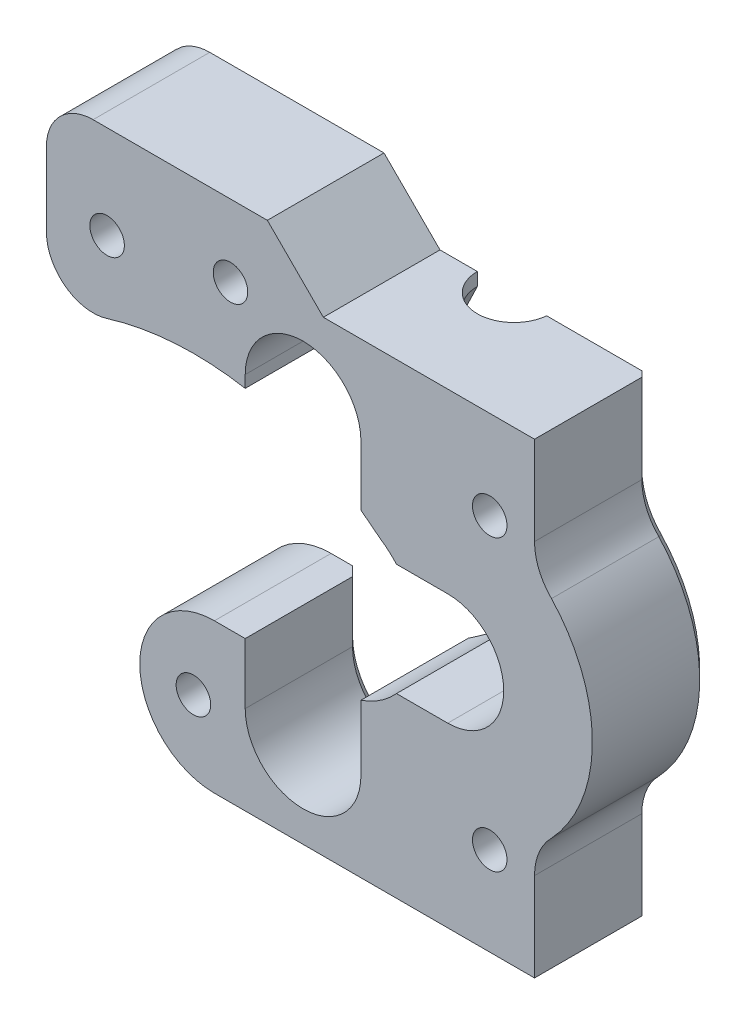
SolidWorks part; units mm, degrees
ref_plane "Front Plane" through (0, 0, 0) normal (0, 0, 1) x (1, 0, 0)
ref_plane "Top Plane" through (0, 0, 0) normal (0, 1, 0) x (1, 0, 0)
ref_plane "Right Plane" through (0, 0, 0) normal (1, 0, 0) x (0, 0, -1)
sketch "Sketch1" plane through (0, 0, 0) normal (0, 0, 1) x (1, 0, 0)
  line L1 (0, 0) -> (50, 0)
  line L2 (0, 0) -> (0, 50)
  line L3 (0, 50) -> (50, 50)
  line L4 (50, 0) -> (50, 50)
  dimension "D1" = 50
  dimension "D2" = 50
extrude "Boss-Extrude1" add sketch "Sketch1" along normal blind 15
sketch "Sketch2" plane through (0, 0, 15) normal (0, 0, 1) x (1, 0, 0)
  line L0 (25, 50) -> (25, 0) construction
  line L1 (50, 50) -> (0, 50) construction
  line L2 (0, 0) -> (50, 0) construction
  line L3 (0, 25) -> (50, 25) construction
  line L4 (0, 50) -> (0, 0) construction
  line L5 (50, 0) -> (50, 50) construction
  circle A0 centre (40.5, 40.5) radius 1.75
  circle A1 centre (9.5, 40.5) radius 1.75
  circle A2 centre (9.5, 9.5) radius 1.75
  circle A3 centre (40.5, 9.5) radius 1.75
  dimension "D1" = 3.5
  dimension "D2" = 3.5
  dimension "D3" = 3.5
  dimension "D4" = 3.5
  dimension "D5" = 15.5
  dimension "D6" = 15.5
  dimension "D7" = 15.5
  dimension "D9" = 15.5
  dimension "D10" = 15.5
  dimension "D11" = 15.5
  dimension "D12" = 15.5
  dimension "D8" = 15.5
extrude "Cut-Extrude1" cut sketch "Sketch2" against normal up to surface (15 mm away)
sketch "Sketch3" plane through (0, 0, 15) normal (0, 0, 1) x (1, 0, 0)
  line L0 (0, 50) -> (50, 0) construction
  circle A0 centre (25, 25) radius 6
  dimension "D1" = 12
extrude "Cut-Extrude2" cut sketch "Sketch3" against normal up to surface (15 mm away)
ref_plane "Plane1" through (0, 0, 15) normal (0, -1, 0) x (-1, 0, 0)
sketch "Sketch4" plane through (0, 50, 0) normal (0, 1, 0) x (1, 0, 0)
  line L0 (50, -7.5) -> (0, -7.5) construction
  line L1 (50, -15) -> (50, 0) construction
  line L2 (0, -15) -> (0, 0) construction
  line L3 (25, 0) -> (25, -15) construction
  line L4 (50, 0) -> (0, 0) construction
  line L5 (50, -15) -> (0, -15) construction
  circle A0 centre (19.6, -7.5) radius 1.75
  dimension "D1" = 5.4
  dimension "D2" = 3.5
extrude "Cut-Extrude3" cut sketch "Sketch4" against normal up to surface (50 mm away)
sketch "Sketch5" plane through (0, 50, 0) normal (0, 1, 0) x (1, 0, 0)
  circle A0 centre (19.6, -7.5) radius 3.925
  dimension "D1" = 7.85
extrude "Cut-Extrude4" cut sketch "Sketch5" against normal blind 1.39
sketch "Sketch6" plane through (0, 48.61, 0) normal (0, 1, 0) x (1, 0, 0)
  circle A0 centre (19.6, -7.5) radius 5.25
  dimension "D1" = 10.5
extrude "Cut-Extrude5" cut sketch "Sketch6" against normal blind 2.75
chamfer "Chamfer1" distance 1.325 distance2 2.75 1 edges at (19.6, 48.61, 12.75)
sketch "Sketch7" plane through (0, 45.86, 0) normal (0, 1, 0) x (1, 0, 0)
  circle A0 centre (19.6, -7.5) radius 5.3006
extrude "Cut-Extrude6" cut sketch "Sketch7" against normal blind 4.4
sketch "Sketch8" plane through (0, 41.46, 0) normal (0, 1, 0) x (1, 0, 0)
  circle A0 centre (19.6, -7.5) radius 3.55
  dimension "D1" = 7.1
extrude "Cut-Extrude7" cut sketch "Sketch8" against normal blind 4
sketch "Sketch21" plane through (0, 0, 15) normal (0, 0, 1) x (1, 0, 0)
  line L0 (25, 31) -> (25, 19)
  line L1 (25, 19) -> (0, 19)
  line L2 (0, 50) -> (0, 0) construction
  line L3 (0, 19) -> (0, 31)
  line L4 (0, 31) -> (25, 31)
  circle A0 centre (25, 25) radius 6 construction
extrude "Cut-Extrude8" cut sketch "Sketch21" against normal through all
chamfer "Chamfer2" distance 1.5 distance2 5 1 edges at (19.6, 31, 9.25)
sketch "Sketch22" plane through (0, 0, 15) normal (0, 0, 1) x (1, 0, 0)
  line L0 (31, 25) -> (0, 25) construction
  line L2 (0, 50) -> (0, 31) construction
  arc A0 (25, 19) -> (25, 31) centre (25, 25) ccw construction
  circle A1 centre (12.8, 25) radius 9
  dimension "D1" = 18
  dimension "D2" = 12.8
extrude "Cut-Extrude9" cut sketch "Sketch22" against normal through all
sketch "Sketch23" plane through (0, 0, 15) normal (0, 0, 1) x (1, 0, 0)
  line L0 (12.8, 34) -> (12.8, 16)
  line L1 (12.8, 16) -> (0, 16)
  line L2 (0, 19) -> (0, 0) construction
  line L3 (0, 16) -> (0, 34)
  line L4 (0, 50) -> (0, 31) construction
  line L5 (0, 34) -> (12.8, 34)
  arc A0 (19.5082, 31) -> (6.0918, 31) centre (12.8, 25) ccw construction
  arc A1 (6.0918, 19) -> (19.5082, 19) centre (12.8, 25) ccw construction
extrude "Cut-Extrude11" cut sketch "Sketch23" against normal through all contours L3 L5 L0 L1
sketch "Sketch24" plane through (0, 0, 15) normal (0, 0, 1) x (1, 0, 0)
  line L0 (40.5, 40.5) -> (9.5, 40.5) construction
  circle A0 centre (29.5, 40.5) radius 1.85
  circle A1 centre (40.5, 40.5) radius 1.75 construction
  dimension "D1" = 3.7
  dimension "D2" = 11
extrude "Cut-Extrude12" cut sketch "Sketch24" against normal through all
sketch "Sketch25" plane through (0, 0, 0) normal (0, 0, -1) x (-1, 0, 0)
  line L1 (-34.1765, 40.5) -> (-31.8383, 36.45)
  line L2 (-31.8383, 36.45) -> (-27.1617, 36.45)
  line L3 (-27.1617, 36.45) -> (-24.8235, 40.5)
  line L4 (-24.8235, 40.5) -> (-27.1617, 44.55)
  line L5 (-27.1617, 44.55) -> (-31.8383, 44.55)
  line L6 (-31.8383, 44.55) -> (-34.1765, 40.5)
  circle A0 centre (-29.5, 40.5) radius 4.05 construction
  dimension "D1" = 8.1
extrude "Cut-Extrude13" cut sketch "Sketch25" against normal blind 3
sketch "Sketch27" plane through (0, 0, 15) normal (0, 0, 1) x (1, 0, 0)
  line L0 (40.5, 9.5) -> (9.5, 9.5) construction
  line L1 (29.5, 40.5) -> (29.5, 9.5) construction
  circle A0 centre (29.5, 9.5) radius 1.85
  dimension "D1" = 3.7
extrude "Cut-Extrude14" cut sketch "Sketch27" against normal through all
sketch "Sketch28" plane through (0, 0, 0) normal (0, 0, -1) x (-1, 0, 0)
  line L1 (-24.8235, 9.5) -> (-27.1617, 13.55)
  line L2 (-27.1617, 13.55) -> (-31.8383, 13.55)
  line L3 (-31.8383, 13.55) -> (-34.1765, 9.5)
  line L4 (-34.1765, 9.5) -> (-31.8383, 5.45)
  line L5 (-31.8383, 5.45) -> (-27.1617, 5.45)
  line L6 (-27.1617, 5.45) -> (-24.8235, 9.5)
  circle A0 centre (-29.5, 9.5) radius 4.05 construction
  dimension "D1" = 8.1
extrude "Cut-Extrude15" cut sketch "Sketch28" against normal up to surface (3 mm away)
sketch "Sketch26" plane through (0, 0, 15) normal (0, 0, 1) x (1, 0, 0)
  line L0 (11.6731, 50) -> (11.6731, 56)
  line L1 (50, 50) -> (0, 50) construction
  line L2 (11.6731, 56) -> (0, 56)
  line L3 (0, 56) -> (0, 50)
  line L13 (12.8, 16) -> (0, 16)
  line L14 (0, 16) -> (0, 0)
  line L15 (0, 0) -> (50, 0)
  line L16 (50, 0) -> (50, 50)
  line L17 (50, 50) -> (0, 50)
  line L18 (0, 50) -> (0, 34)
  line L19 (0, 34) -> (12.8, 34)
  line L20 (19.5082, 31) -> (25, 31)
  line L21 (25, 19) -> (19.5082, 19)
  line L26 (11.6731, 50) -> (0, 50)
  arc A3 (19.5082, 31) -> (12.8, 34) centre (12.8, 25) ccw
  arc A4 (25, 19) -> (25, 31) centre (25, 25) ccw
  arc A5 (12.8, 16) -> (19.5082, 19) centre (12.8, 25) ccw
  dimension "D2" = 6
  dimension "D1" = 0
extrude "Boss-Extrude5" add sketch "Sketch26" against normal up to surface (15 mm away)
sketch "Sketch29" plane through (0, 0, 0) normal (0, 0, -1) x (-1, 0, 0)
  line L0 (0, 34) -> (0, 56)
  line L1 (0, 56) -> (8, 56)
  line L2 (8, 56) -> (8, 34)
  line L3 (8, 34) -> (0, 34)
  dimension "D1" = 8
extrude "Boss-Extrude6" add sketch "Sketch29" against normal up to surface (15 mm away)
sketch "Sketch30" plane through (0, 0, 15) normal (0, 0, 1) x (1, 0, 0)
  line L0 (9.5, 40.5) -> (9.5, 56) construction
  line L1 (11.6731, 56) -> (-8, 56) construction
  line L2 (9.5, 40.5) -> (-8, 58) construction
  line L3 (-8, 56) -> (-8, 34) construction
  circle A0 centre (1.7218, 48.2782) radius 1.85
  circle A1 centre (9.5, 40.5) radius 1.75 construction
  dimension "D2" = 3.7
  dimension "D3" = 11
  dimension "D4" = 7.7782
  dimension "D1" = 45
extrude "Cut-Extrude16" cut sketch "Sketch30" against normal through all
sketch "Sketch31" plane through (0, 0, 0) normal (0, 0, -1) x (-1, 0, 0)
  line L1 (-6.3984, 48.2782) -> (-4.0601, 44.2282)
  line L2 (-4.0601, 44.2282) -> (0.6164, 44.2282)
  line L3 (0.6164, 44.2282) -> (2.9547, 48.2782)
  line L4 (2.9547, 48.2782) -> (0.6164, 52.3282)
  line L5 (0.6164, 52.3282) -> (-4.0601, 52.3282)
  line L6 (-4.0601, 52.3282) -> (-6.3984, 48.2782)
  circle A0 centre (-1.7218, 48.2782) radius 4.05 construction
  dimension "D1" = 8.1
extrude "Cut-Extrude17" cut sketch "Sketch31" against normal up to surface (3 mm away)
sketch "Sketch32" plane through (0, 0, 0) normal (-1, 0, 0) x (0, 0, 1)
  line L0 (15, 16) -> (15, 0) construction
  line L1 (0, 16) -> (15, 16)
  line L2 (0, 16) -> (0, 0)
  line L3 (0, 0) -> (15, 0)
  line L4 (15, 16) -> (15, 0)
extrude "Boss-Extrude7" add sketch "Sketch32" along normal up to surface (8 mm away)
sketch "Sketch33" plane through (0, 0, 0) normal (0, 0, -1) x (-1, 0, 0)
  line L0 (8, 56) -> (-50, 56)
  line L1 (-50, 56) -> (-50, 0)
  line L2 (-50, 0) -> (8, 0)
  line L3 (8, 0) -> (8, 56)
extrude "Cut-Extrude18" cut sketch "Sketch33" against normal blind 7.5
sketch "Sketch34" plane through (0, 0, 15) normal (0, 0, 1) x (1, 0, 0)
  line L0 (40.5, 40.5) -> (-8, 40.5) construction
  line L1 (-8, 56) -> (-8, 34) construction
  line L2 (40.5, 9.5) -> (-8, 9.5) construction
  line L3 (-8, 0) -> (-8, 16) construction
  line L4 (12.8, 16) -> (-8, 16) construction
  line L5 (3.3, 40.5) -> (3.3, 34)
  line L6 (3.3, 34) -> (15.7, 33.52)
  line L7 (15.7, 33.52) -> (15.7, 40.5)
  line L8 (15.7, 16.48) -> (3.3, 16)
  line L9 (3.3, 16) -> (3.3, 9.5)
  line L10 (15.7, 16.48) -> (15.7, 9.5)
  line L11 (-8, 34) -> (12.8, 34) construction
  circle A0 centre (40.5, 40.5) radius 6.2
  circle A1 centre (40.5, 9.5) radius 6.2
  arc A2 (3.3, 40.5) -> (15.7, 40.5) centre (9.5, 40.5) cw
  arc A3 (15.7, 9.5) -> (3.3, 9.5) centre (9.5, 9.5) cw
  arc A6 (12.8, 16) -> (19.5082, 19) centre (12.8, 25) ccw construction
  arc A7 (19.5082, 31) -> (12.8, 34) centre (12.8, 25) ccw construction
  dimension "D1" = 12.4
  dimension "D2" = 12.4
  dimension "D3" = 6.2
  dimension "D4" = 6.2
extrude "Cut-Extrude19" cut sketch "Sketch34" against normal through all contours A3 L9 L8 L10 | L7 A2 L5 L6
sketch "Sketch35" plane through (0, 0, 15) normal (0, 0, 1) x (1, 0, 0)
  circle A0 centre (-2.25, 8) radius 1.85
  dimension "D1" = 3.7
extrude "Cut-Extrude20" cut sketch "Sketch35" against normal through all
sketch "Sketch39" plane through (0, 0, 15) normal (0, 0, 1) x (1, 0, 0)
  line L0 (-8, 56) -> (11.6731, 56)
  line L1 (11.6731, 56) -> (11.6731, 50)
  line L2 (11.6731, 50) -> (50, 50)
  line L3 (50, 50) -> (50, 0)
  line L4 (50, 0) -> (-8, 0)
  line L5 (-8, 0) -> (-8, 16)
  line L6 (-8, 16) -> (3.3, 16)
  line L7 (3.3, 16) -> (3.3, 9.5)
  line L8 (15.7, 9.5) -> (15.7, 16.48)
  line L9 (19.5082, 19) -> (25, 19)
  line L10 (19.5082, 19) -> (25, 19) construction
  line L11 (25, 31) -> (19.5082, 31)
  line L12 (15.7, 33.52) -> (15.7, 40.5)
  line L13 (15.7, 33.52) -> (15.7, 40.5) construction
  line L14 (3.3, 40.5) -> (3.3, 34)
  line L15 (3.3, 34) -> (-8, 34)
  line L16 (-8, 34) -> (-8, 56)
  arc A0 (25, 19) -> (25, 31) centre (25, 25) ccw construction
  arc A1 (15.7, 40.5) -> (3.3, 40.5) centre (9.5, 40.5) ccw construction
  circle A2 centre (1.7218, 48.2782) radius 1.85
  circle A3 centre (29.5, 40.5) radius 1.85
  circle A4 centre (40.5, 40.5) radius 6.2
  circle A5 centre (40.5, 9.5) radius 6.2
  circle A6 centre (29.5, 9.5) radius 1.85
  circle A7 centre (-2.25, 8) radius 1.85
  arc A8 (25, 31) -> (25, 19) centre (25, 25) cw
  arc A9 (15.7, 33.52) -> (19.5082, 31) centre (12.8, 25) cw
  arc A10 (19.5082, 19) -> (15.7, 16.48) centre (12.8, 25) cw
  arc A11 (3.3, 9.5) -> (15.7, 9.5) centre (9.5, 9.5) ccw
  arc A12 (3.3, 40.5) -> (15.7, 40.5) centre (9.5, 40.5) cw
extrude "Boss-Extrude10" add sketch "Sketch39" along normal blind 5 contours M26 M7 M8 M9 M10 M11 M12 M13 M14 M15 M16 M17 M18 M19 M20 M21 M22 M23 M24 M25 M2 M4 M6 M5 M3 M1
fillet "Fillet2" radius 8 2 edges at (-8, 16, 13.75) (-8, 0, 13.75)
sketch "Sketch40" plane through (0, 0, 20) normal (0, 0, 1) x (1, 0, 0)
  line L0 (-8, 34) -> (-18, 34)
  line L1 (-18, 34) -> (-18, 56)
  line L3 (-18, 56) -> (-8, 56)
  line L4 (-8, 56) -> (-8, 34)
  dimension "D1" = 10
extrude "Boss-Extrude11" add sketch "Sketch40" against normal up to surface (12.5 mm away)
sketch "Sketch42" plane through (0, 0, 20) normal (0, 0, 1) x (1, 0, 0)
  line L0 (-18, 56) -> (-18, 34) construction
  line L1 (-18, 34) -> (3.3, 34) construction
  circle A0 centre (-11.5, 46) radius 1.85
  dimension "D1" = 3.7
  dimension "D2" = 6.5
  dimension "D3" = 12
extrude "Cut-Extrude22" cut sketch "Sketch42" against normal through all
sketch "Sketch43" plane through (0, 0, 20) normal (0, 0, 1) x (1, 0, 0)
  line L1 (3.3, 34) -> (3.3, 40.5) construction
  line L2 (-18, 56) -> (-18, 34) construction
  line L3 (-18, 35.4702) -> (-18, 34)
  line L4 (-18, 34) -> (3.3, 34)
  line L5 (3.3, 34) -> (3.3, 39.2151)
  arc A0 (3.3, 39.2151) -> (-18, 35.4702) centre (-2.1892, 7.9892) ccw
extrude "Cut-Extrude23" cut sketch "Sketch43" against normal through all
chamfer "Chamfer3" distance 6 angle 45 1 edges at (11.6731, 56, 13.75)
fillet "Fillet3" radius 5 2 edges at (-18, 56, 13.75) (-18, 35.4702, 13.75)
sketch "Sketch44" plane through (0, 0, 20) normal (0, 0, 1) x (1, 0, 0)
  line L0 (34.3, 40.5) -> (34.3, 50)
  line L1 (50, 50) -> (11.6731, 50) construction
  line L2 (34.3, 9.5) -> (34.3, 0)
  line L3 (0, 0) -> (50, 0) construction
  line L4 (40.5, 40.5) -> (34.3, 40.5) construction
  line L5 (40.5, 9.5) -> (34.3, 9.5) construction
  line L6 (40.5, 40.5) -> (36.1159, 36.1159) construction
  line L7 (40.5, 9.5) -> (36.1159, 13.8841) construction
  line L8 (40.5, 40.5) -> (40.5, 9.5) construction
  line L9 (34.3, 50) -> (50, 50)
  line L10 (50, 50) -> (50, 0)
  line L11 (50, 0) -> (34.3, 0)
  circle A0 centre (40.5, 40.5) radius 6.2 construction
  circle A1 centre (40.5, 9.5) radius 6.2 construction
  arc A2 (36.1159, 36.1159) -> (36.1159, 13.8841) centre (24.2156, 25) cw
  arc A3 (34.3, 40.5) -> (36.1159, 36.1159) centre (40.5, 40.5) ccw
  arc A4 (36.1159, 13.8841) -> (34.3, 9.5) centre (40.5, 9.5) ccw
  dimension "D1" = 45
  dimension "D2" = 45
extrude "Cut-Extrude24" cut sketch "Sketch44" against normal through all
sketch "Sketch45" plane through (0, 56, 0) normal (0, 1, 0) x (1, 0, 0)
  line L0 (-16, -7.5) -> (-18, -7.5)
  line L1 (-13, -7.5) -> (-18, -7.5) construction
  line L2 (-18, -7.5) -> (-18, -8.5)
  line L3 (-18, -20) -> (-18, -7.5) construction
  line L4 (-18, -8.5) -> (-16, -7.5)
  dimension "D1" = 2
  dimension "D2" = 1
extrude "Cut-Extrude25" cut sketch "Sketch45" against normal up to vertex
chamfer "Chamfer4" distance 1 angle 45 5 edges at (34.7719, 11.8726, 7.5) (34.3, 4.75, 7.5) (40.5, 25, 7.5) (34.7719, 38.1274, 7.5) (34.3, 45.25, 7.5)
chamfer "Chamfer5" distance 1 angle 45 5 edges at (3.3, 39.8576, 7.5) (7.4163, 46.3394, 7.5) (15.7, 12.99, 7.5) (3.3, 12.75, 7.5) (9.5, 3.3, 7.5)
chamfer "Chamfer6" distance 0.4 angle 45 5 edges at (-13.35, 46, 7.5) (-0.1282, 48.2782, 7.5) (27.65, 40.5, 7.5) (-4.1, 8, 7.5) (27.65, 9.5, 7.5)
chamfer "Chamfer7" distance 0.4 angle 45 4 edges at (17.85, 36.73, 7.5) (21.35, 36.73, 7.5) (23.15, 39.46, 7.5) (24.9006, 43.66, 7.5)
chamfer "Chamfer8" distance 0.4 angle 45 3 edges at (23.175, 19, 7.5) (23.925, 31, 7.5) (31, 25, 7.5)
sketch "Sketch46" plane through (0, 0, 20) normal (0, 0, 1) x (1, 0, 0)
  line L0 (15.5, 34.2702) -> (17.7666, 32.5055)
  line L1 (17.7666, 32.5055) -> (15.7, 33.52)
  line L2 (15.7, 33.52) -> (15.5, 34.2702)
  arc A0 (19.5082, 31) -> (15.7, 33.52) centre (12.8, 25) ccw construction
extrude "Cut-Extrude26" cut sketch "Sketch46" against normal through all
sketch "Sketch48" plane through (0, 0, 0) normal (0, -1, 0) x (-1, 0, 0)
  circle A0 centre (-19.6, -7.5) radius 3
  dimension "D1" = 6
extrude "Cut-Extrude27" cut sketch "Sketch48" against normal offset from surface (17 mm away) 2
chamfer "Chamfer9" distance 2 angle 60 1 edges at (20.2962, 17, 10.4181)
fillet "Fillet4" radius 4 1 edges at (19.6, 0, 10.5)
chamfer "Chamfer10" distance 0.4 angle 45 6 edges at (28.4125, 50, 7.5) (29.95, 0, 7.5) (23.7716, 1.1716, 7.5) (21.35, 17.1505, 7.5) (21.975, 14.6184, 7.5) (22.6, 8.7679, 7.5)
equation "\"D2@Sketch2\"=\"D1@Sketch2\""
equation "\"D3@Sketch2\"=\"D1@Sketch2\""
equation "\"D4@Sketch2\"=\"D1@Sketch2\""
equation "\"D6@Sketch2\"=\"D5@Sketch2\""
equation "\"D12@Sketch2\"=\"D11@Sketch2\""
equation "\"D9@Sketch2\"=\"D8@Sketch2\""
equation "\"D10@Sketch2\"=\"D7@Sketch2\""
equation "\"D3@Chamfer1\"=\"D1@Cut-Extrude5\""
equation "\"D1@Chamfer1\"=(\"D1@Sketch6\"-\"D1@Sketch5\")/2"
equation "\"D1@Sketch28\"=\"D1@Sketch25\""
equation "\"D1@Sketch27\"=\"D1@Sketch24\""
equation "\"D2@Sketch30\"=\"D1@Sketch24\""
equation "\"D1@Sketch31\"=\"D1@Sketch25\""
equation "\"D2@Sketch34\"=\"D1@Sketch34\""
equation "\"D3@Sketch34\"=\"D2@Sketch34\"/2"
equation "\"D4@Sketch34\"=\"D1@Sketch34\"/2"
equation "\"D1@Sketch35\"=\"D1@Sketch24\""
